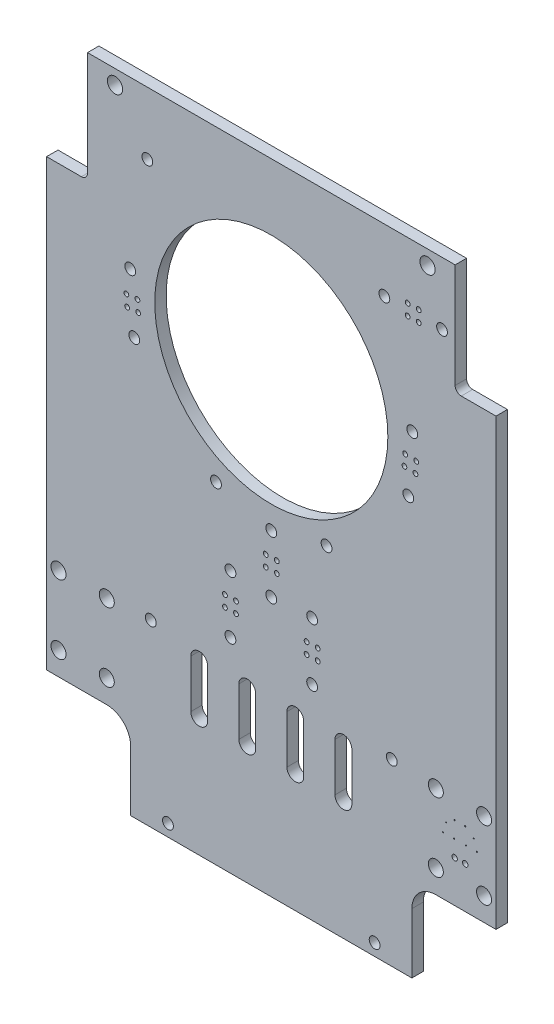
SolidWorks part; units mm, degrees
ref_plane "Front" through (0, 0, 0) normal (0, 0, 1) x (1, 0, 0)
ref_plane "Top" through (0, 0, 0) normal (0, 1, 0) x (1, 0, 0)
ref_plane "Right" through (0, 0, 0) normal (1, 0, 0) x (0, 0, -1)
imported_body "Imported1"
sketch "Sketch1" plane through (0, 0, 4.75) normal (0, 0, 1) x (1, 0, 0)
  line L0 (76.5, -20) -> (93.5, -20) construction
  line L1 (-93.5, 26) -> (-76.482, 26)
  line L2 (-93.5, 26) -> (-93.5, -20)
  line L3 (-93.5, -20) -> (-76.482, -20)
  line L4 (-76.482, 26) -> (-76.482, -20)
  dimension "D1" = 17.018
extrude "Cut-Extrude1" cut sketch "Sketch1" against normal blind 24.638
fillet "Fillet1" radius 2.54 2 edges at (76.5, -20, 2.375) (-76.482, -20, 2.375)
sketch "Sketch2" plane through (0, 0, 4.75) normal (0, 0, 1) x (1, 0, 0)
  line L0 (76.5, 26) -> (76.5, -17.46) construction
  line L1 (-76.482, 26) -> (76.5, 26)
  line L2 (-76.482, 26) -> (-76.482, 7.7618)
  line L3 (-76.482, 7.7618) -> (76.5, 7.7618)
  line L4 (76.5, 26) -> (76.5, 7.7618)
  dimension "D1" = 18.2382
extrude "Extrude1" add sketch "Sketch2" against normal up to surface (4.75 mm away)
sketch "Sketch3" plane through (0, 0, 4.75) normal (0, 0, 1) x (1, 0, 0)
  line L0 (-76.482, 20.02) -> (76.5, 20.02) construction
  line L1 (-76.482, -17.46) -> (-76.482, 26) construction
  line L2 (76.5, 26) -> (76.5, -17.46) construction
  line L4 (-93.5, -205) -> (-93.5, -20) construction
  line L5 (0, 0) -> (0, 100.5721) construction
  circle A0 centre (-65.0266, 20.02) radius 3.175
  circle A1 centre (65.0266, 20.02) radius 3.175
  circle A2 centre (-43, -235) radius 2.25 construction
  dimension "D3" = 6.35
  dimension "D1" = 255.02
  dimension "D2" = 28.4734
extrude "Cut-Extrude2" cut sketch "Sketch3" against normal blind 24.638
